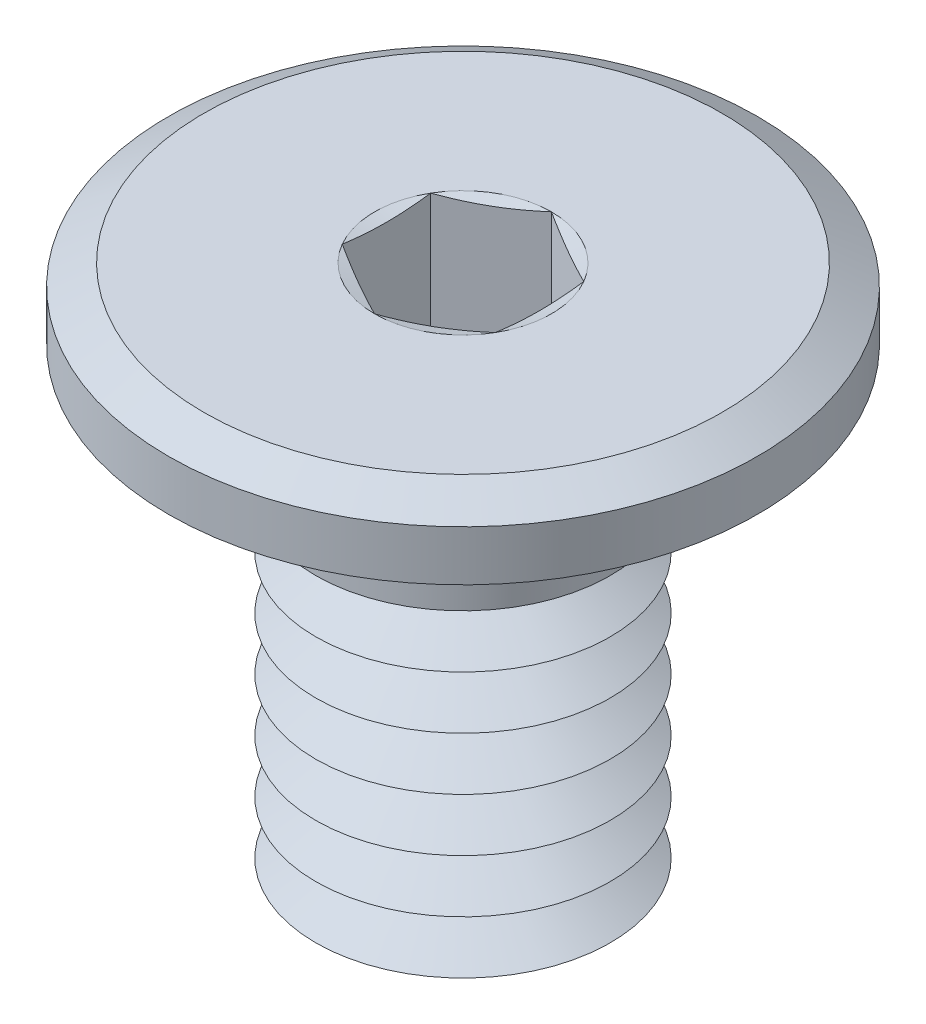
SolidWorks part; units mm, degrees
ref_plane "Front Plane" through (0, 0, 0) normal (0, 0, 1) x (1, 0, 0)
ref_plane "Top Plane" through (0, 0, 0) normal (0, 1, 0) x (1, 0, 0)
ref_plane "Right Plane" through (0, 0, 0) normal (1, 0, 0) x (0, 0, -1)
sketch "Sketch1" plane through (0, 0, 0) normal (0, 1, 0) x (1, 0, 0)
  circle A0 centre (0, 0) radius 2.5
  dimension "D1" = 5
extrude "Boss-Extrude1" add sketch "Sketch1" against normal blind 0.6
sketch "Sketch2" plane through (0, -0.6, 0) normal (0, -1, 0) x (1, 0, 0)
  circle A0 centre (0, 0) radius 1.25
  dimension "D1" = 2.5
extrude "Boss-Extrude2" add sketch "Sketch2" along normal blind 4
sketch "Sketch3" plane through (0, 0, 0) normal (1, 0, 0) x (0, 0, -1)
  line L0 (0, 0.9906) -> (0, -8.2999) construction
sketch "Sketch5" plane through (0, 0, 0) normal (1, 0, 0) x (0, 0, -1)
  line L0 (-1.25, -4.825) -> (-0.8603, -4.6)
  line L1 (-1.25, -0.6) -> (-1.25, -4.6) construction
  line L2 (-0.8603, -4.6) -> (-1.25, -4.375)
  line L3 (-1.25, -0.6) -> (-1.25, -4.6) construction
  line L4 (-1.25, -4.375) -> (-1.25, -4.825)
  line L6 (-1.25, -0.6) -> (-1.25, -4.6) construction
  line L7 (-1.25, -0.6) -> (-1.25, -4.6) construction
  line L14 (-1.25, -4.6) -> (1.25, -4.6) construction
  dimension "D1" = 0.45
revolve "Cut-Revolve1" cut sketch "Sketch5" angle 360 about L0
pattern_linear "LPattern1" count 7 spacing 0.45 along (0, 1, 0) of "Cut-Revolve1"
fillet "Fillet1" radius 0.1 1 edges at (0, -0.6, -1.25)
chamfer "Chamfer2" distance 0.3 angle 30 1 edges at (0, 0, 2.5)
sketch "Sketch6" plane through (0, 0, 0) normal (0, 1, 0) x (1, 0, 0)
  line L1 (0, 0.7506) -> (-0.65, 0.3753)
  line L2 (-0.65, 0.3753) -> (-0.65, -0.3753)
  line L3 (-0.65, -0.3753) -> (0, -0.7506)
  line L4 (0, -0.7506) -> (0.65, -0.3753)
  line L5 (0.65, -0.3753) -> (0.65, 0.3753)
  line L6 (0.65, 0.3753) -> (0, 0.7506)
  circle A0 centre (0, 0) radius 0.65 construction
  dimension "D1" = 1.3
extrude "Cut-Extrude1" cut sketch "Sketch6" against normal blind 1.2
sketch "Sketch7" plane through (0, -1.2, 0) normal (0, 1, 0) x (1, 0, 0)
  line L0 (-0.65, 0.3753) -> (-0.65, -0.3753) construction
  circle A0 centre (0, 0) radius 0.65
extrude "Cut-Extrude2" cut sketch "Sketch7" against normal through all draft 60
sketch "Sketch8" plane through (0, 0, 0) normal (0, 1, 0) x (1, 0, 0)
  circle A0 centre (0, 0) radius 0.7506
extrude "Cut-Extrude3" cut sketch "Sketch8" against normal through all draft 75
